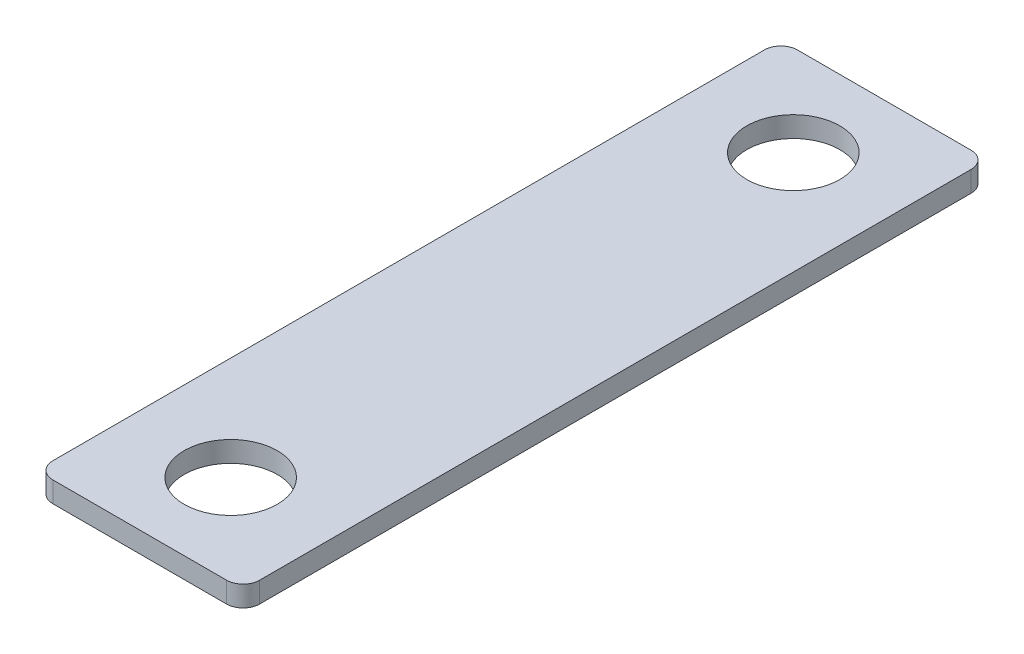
SolidWorks part; units mm, degrees
ref_plane "Front Plane" through (0, 0, 0) normal (0, 0, 1) x (1, 0, 0)
ref_plane "Top Plane" through (0, 0, 0) normal (0, 1, 0) x (1, 0, 0)
ref_plane "Right Plane" through (0, 0, 0) normal (1, 0, 0) x (0, 0, -1)
sketch "Sketch1" plane through (0, 0, 0) normal (0, 1, 0) x (1, 0, 0)
  line L1 (-15.875, 57.15) -> (15.875, 57.15)
  line L2 (-15.875, 57.15) -> (-15.875, -57.15)
  line L3 (-15.875, -57.15) -> (15.875, -57.15)
  line L4 (15.875, 57.15) -> (15.875, -57.15)
  circle A0 centre (0, 43.18) radius 7.1438
  circle A1 centre (0, -43.18) radius 7.1438
  point P4 (0, 57.15)
  point P6 (-15.875, 0)
  dimension "D3" = 14.2875
  dimension "D4" = 14.2875
  dimension "D1" = 31.75
  dimension "D2" = 114.3
  dimension "D5" = 86.36
  dimension "D6" = 43.18
extrude "Boss-Extrude1" add sketch "Sketch1" along normal blind 3.175
fillet "Fillet1" radius 2.54 4 edges at (-15.875, 1.5875, -57.15) (15.875, 1.5875, -57.15) (-15.875, 1.5875, 57.15) (15.875, 1.5875, 57.15)
